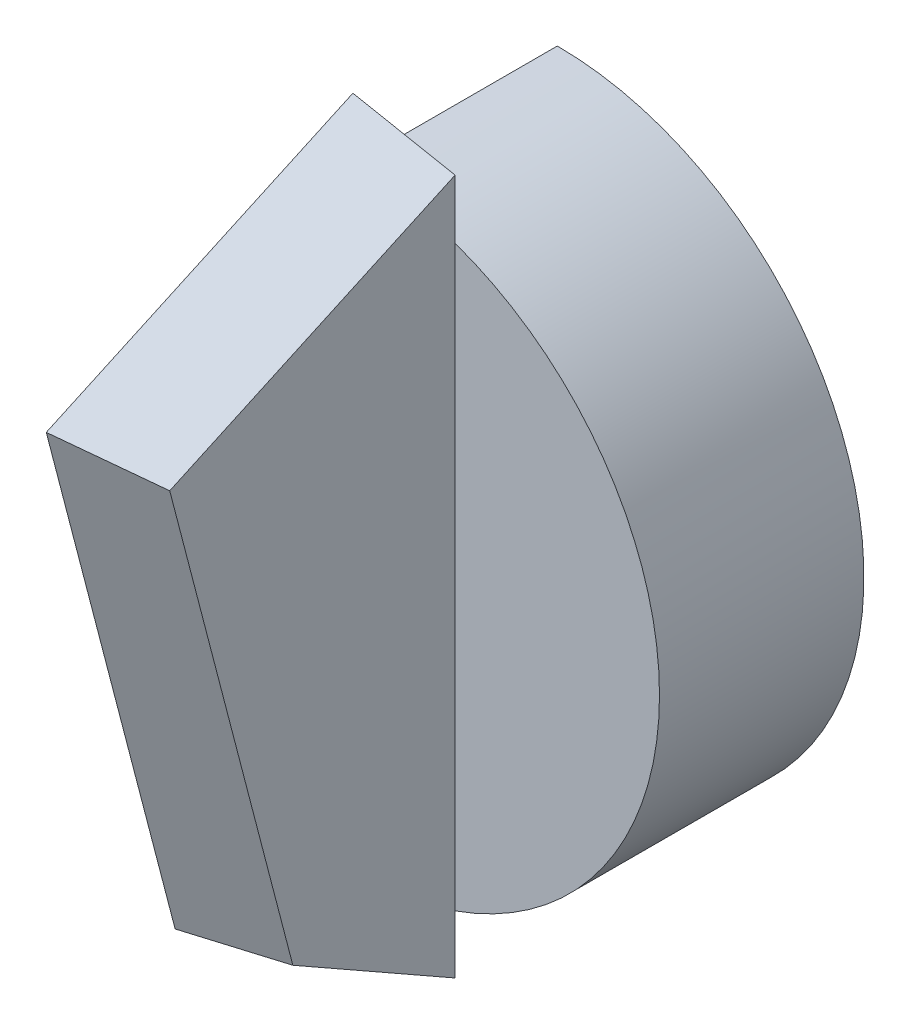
SolidWorks part; units mm, degrees
ref_plane "Front Plane" through (0, 0, 0) normal (0, 0, 1) x (1, 0, 0)
ref_plane "Top Plane" through (0, 0, 0) normal (0, 1, 0) x (1, 0, 0)
ref_plane "Right Plane" through (0, 0, 0) normal (1, 0, 0) x (0, 0, -1)
sketch "Sketch1" plane through (0, 0, 0) normal (0, 0, 1) x (1, 0, 0)
  line L0 (0, 15) -> (0, -15)
  arc A0 (0, -15) -> (0, 15) centre (0, 0) ccw
  dimension "D1" = 15
extrude "Extrude1" add sketch "Sketch1" along normal blind 10
sketch "Sketch2" plane through (0, 0, 0) normal (1, 0, 0) x (0, 0, -1)
  line L0 (-10, 18) -> (-10, -18)
  line L1 (-10, -18) -> (-18.6955, -13.0616)
  line L2 (-18.6955, -13.0616) -> (-25, 11.1304)
  line L3 (-25, 11.1304) -> (-10, 18)
  line L4 (-10, 15) -> (-10, -15) construction
  dimension "D1" = 100
  dimension "D2" = 10
  dimension "D3" = 25
  dimension "D4" = 15
  dimension "D5" = 18
  dimension "D6" = 18
extrude "Extrude2" add sketch "Sketch2" along normal blind 5
draft "Draft1" type of draft neutral plane draft angle 10 neutral plane "Right Plane" faces to draft 3 parameters "D1"=10
